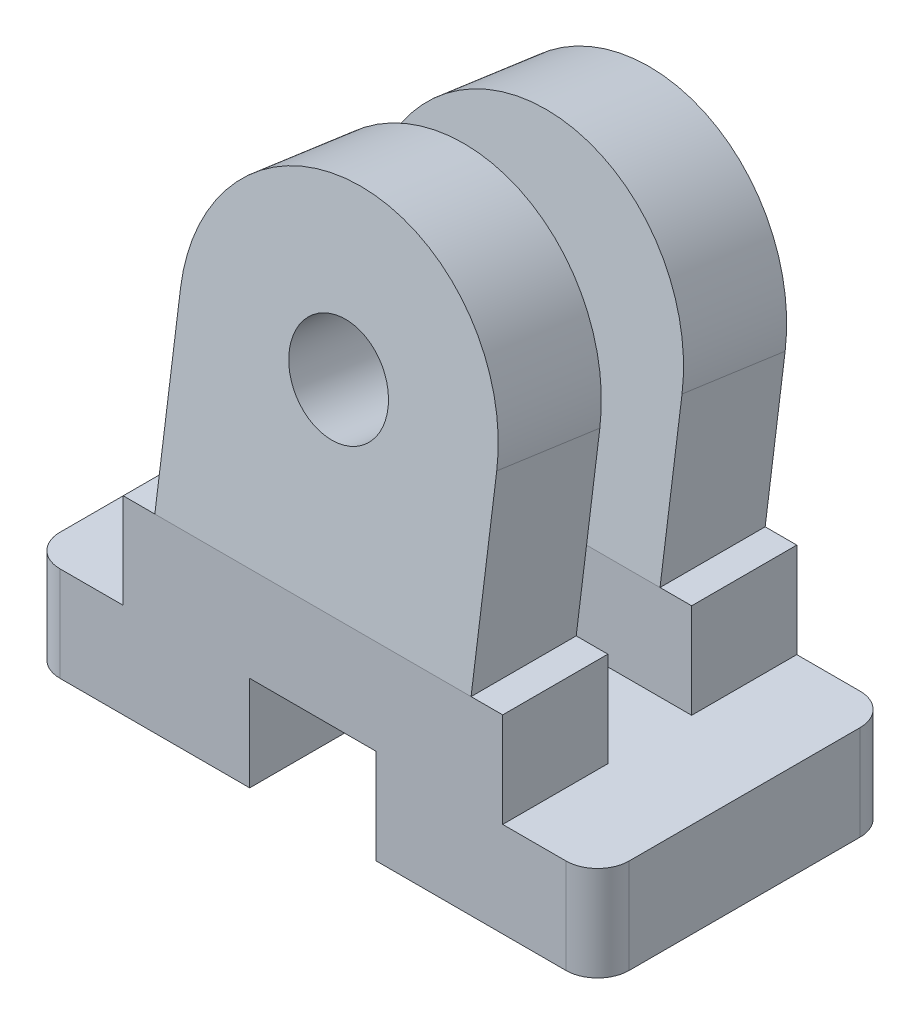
SolidWorks part; units mm, degrees
ref_plane "Front Plane" through (0, 0, 0) normal (0, 0, 1) x (1, 0, 0)
ref_plane "Top Plane" through (0, 0, 0) normal (0, 1, 0) x (1, 0, 0)
ref_plane "Right Plane" through (0, 0, 0) normal (1, 0, 0) x (0, 0, -1)
sketch "Sketch1" plane through (0, 0, 0) normal (0, 1, 0) x (1, 0, 0)
  line L1 (-9, 4.65) -> (9, 4.65)
  line L2 (-9, 4.65) -> (-9, -4.65)
  line L3 (-9, -4.65) -> (9, -4.65)
  line L4 (9, 4.65) -> (9, -4.65)
  dimension "D1" = 9.3
  dimension "D2" = 18
  dimension "D3" = 4.65
  dimension "D4" = 9
extrude "Base" add sketch "Sketch1" along normal blind 3
sketch "Sketch2" plane through (0, 3, 0) normal (0, 1, 0) x (1, 0, 0)
  line L0 (0, 0) -> (-3.9389, 0) construction
  line L1 (9, 4.65) -> (-9, 4.65) construction
  line L2 (-6, 4.65) -> (6, 4.65)
  line L3 (-6, 4.65) -> (-6, 1.325)
  line L4 (-6, 1.325) -> (6, 1.325)
  line L5 (6, 4.65) -> (6, 1.325)
  line L6 (6, -4.65) -> (6, -1.325)
  line L7 (-6, -1.325) -> (6, -1.325)
  line L8 (-6, -4.65) -> (-6, -1.325)
  line L9 (-6, -4.65) -> (6, -4.65)
  dimension "D1" = 12
  dimension "D2" = 6
  dimension "D3" = 1.325
extrude "Base Mid" add sketch "Sketch2" along normal blind 3
sketch "Sketch3" plane through (0, 0, 0) normal (1, 0, 0) x (0, 0, -1)
  line L0 (-4.65, 6) -> (-3.1425, 16.7261)
  line L1 (-3.1425, 16.7261) -> (0.1181, 16.2679)
  line L2 (0.1181, 16.2679) -> (-1.325, 6)
  line L3 (-1.325, 6) -> (-4.65, 6)
  line L4 (1.325, 6) -> (2.7167, 15.9027)
  line L5 (2.7167, 15.9027) -> (5.9773, 15.4444)
  line L6 (5.9773, 15.4444) -> (4.65, 6)
  line L7 (-4.65, 6) -> (-4.65, 11.3081) construction
  line L10 (1.325, 6) -> (4.65, 6)
  line L11 (4.65, 6) -> (4.6455, 5.0133)
  dimension "D1" = 8
  dimension "D4" = 10
extrude "Pulley Head" add sketch "Sketch3" along normal blind 5 and the other way blind 5
sketch "Sketch4" plane through (0, 0.7571, 5.3868) normal (0, 0.1392, 0.9903) x (1, 0, 0)
  line L0 (5, 5.2945) -> (5, 16.126) construction
  line L1 (-5, 16.126) -> (5, 16.126) construction
  line L2 (-5, 11.126) -> (-5, 17.4187)
  line L3 (-5, 5.2945) -> (-5, 16.126) construction
  line L4 (-5, 17.4187) -> (5, 17.4187)
  line L5 (5, 17.4187) -> (5, 11.126)
  circle A0 centre (0, 11.126) radius 1.5625
  arc A1 (5, 11.126) -> (-5, 11.126) centre (0, 11.126) ccw
  point P0 (0, 11.126)
  dimension "D3" = 3.125
  dimension "D1" = 5
  dimension "D2" = 5
extrude "Frame" cut sketch "Sketch4" against normal through all contours A0 | A1 L4 M4 | A1 M2 M3
sketch "Sketch5" plane through (0, 0, 0) normal (0, -1, 0) x (1, 0, 0)
  line L0 (0, 4.65) -> (0, -4.65) construction
  line L1 (-9, 4.65) -> (9, 4.65) construction
  line L2 (9, -4.65) -> (-9, -4.65) construction
  line L4 (-2, 4.65) -> (2, 4.65)
  line L5 (-2, 4.65) -> (-2, -4.65)
  line L6 (-2, -4.65) -> (2, -4.65)
  line L7 (2, 4.65) -> (2, -4.65)
  dimension "D1" = 4
extrude "Base Slot" cut sketch "Sketch5" against normal up to surface (3 mm away)
fillet "Corner Allowances" radius 1 4 edges at (-9, 1.5, -4.65) (-9, 1.5, 4.65) (9, 1.5, -4.65) (9, 1.5, 4.65)
equation "\"D4@Sketch1\"=\"D2@Sketch1\"/2"
equation "\"D3@Sketch1\"=\"D1@Sketch1\"/2"
equation "\"D2@Sketch2\"=\"D1@Sketch2\"/2"
equation "\"D3@Sketch2\"=(\"pulley thickness@values@params.sldprt\"+0.25)/2"
